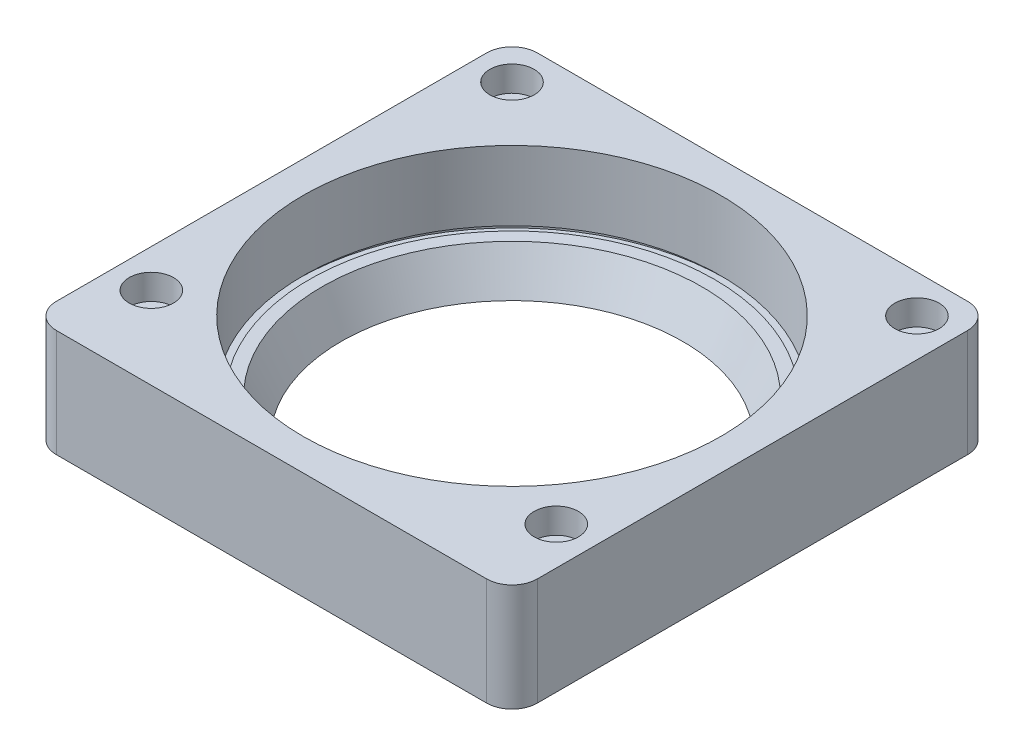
SolidWorks part; units mm, degrees
ref_plane "Plane1" through (0, 0, 0) normal (0, 0, 1) x (1, 0, 0)
ref_plane "Plane2" through (0, 0, 0) normal (0, 1, 0) x (1, 0, 0)
ref_plane "Plane3" through (0, 0, 0) normal (1, 0, 0) x (0, 0, -1)
sketch "Esquisse1" plane through (0, 0, 0) normal (0, 0, 1) x (1, 0, 0)
  line L0 (36, 0) -> (34, 0)
  line L1 (36, 0) -> (36, 6)
  line L2 (36, 6) -> (34, 6)
  line L3 (34, 6) -> (34, 5)
  line L4 (34, 5) -> (32, 5)
  line L5 (32, 5) -> (32, 6)
  line L6 (32, 6) -> (30, 6)
  line L7 (30, 6) -> (27, 0)
  line L8 (32, 0) -> (32, 1.5)
  line L9 (32, 1.5) -> (34, 1.5)
  line L10 (34, 1.5) -> (34, 0)
  line L11 (32, 0) -> (27, 0)
  line L12 (0, 16) -> (0, -10) construction
  dimension "D1" = 2
  dimension "D2" = 1.5
  dimension "D3" = 36
  dimension "D4" = 9
revolve "Base-Révolution" add sketch "Esquisse1" angle 360 about L12
sketch "Esquisse2" plane through (0, 0, 0) normal (0, -1, 0) x (1, 0, 0)
  line L0 (-38, -38) -> (38, -38)
  line L1 (-38, -38) -> (-38, 38)
  line L2 (38, 38) -> (-38, 38)
  line L3 (38, 38) -> (38, -38)
  line L4 (-34.5, -34.5) -> (-34.5, 34.5)
  line L5 (-34.5, 34.5) -> (34.5, 34.5)
  line L6 (34.5, 34.5) -> (34.5, -34.5)
  line L7 (34.5, -34.5) -> (-34.5, -34.5)
  dimension "D1" = 38
  dimension "D2" = 38
  dimension "D3" = 38
  dimension "D4" = 38
  dimension "D5" = 3.5
  dimension "D6" = 3.5
  dimension "D7" = 3.5
  dimension "D8" = 3.5
extrude "Boss.-Extru.1" add sketch "Esquisse2" against normal blind 14
sketch "Esquisse4" plane through (0, 6, 0) normal (0, 1, 0) x (-1, 0, 0)
  circle A0 centre (0, 0) radius 33
  circle A1 centre (0, 0) radius 35
extrude "Boss.-Extru.2" add sketch "Esquisse4" along normal blind 8
sketch "Esquisse5" plane through (0, 14, 0) normal (0, 1, 0) x (-1, 0, 0)
  line L0 (-38, 38) -> (38, 38)
  line L1 (-38, 38) -> (-38, -38)
  line L2 (38, -38) -> (-38, -38)
  line L3 (38, -38) -> (38, 38)
  circle A0 centre (0, 0) radius 33
extrude "Boss.-Extru.3" add sketch "Esquisse5" along normal blind 3
sketch "Esquisse6" plane through (0, 0, 0) normal (0, -1, 0) x (1, 0, 0)
  line L0 (0, 0) -> (0, 52) construction
  line L2 (0, 0) -> (-64, 0) construction
  line L3 (-32, -25) -> (-32, -45) construction
  line L4 (32, -25) -> (32, -45) construction
  line L6 (-59, -32) -> (69, -32) construction
  line L8 (-38, -38) -> (38, -38) construction
  line L9 (38, 38) -> (-38, 38) construction
  circle A0 centre (32, 25) radius 5.5
  circle A1 centre (-32, 25) radius 5.5
  circle A2 centre (-32, -32) radius 5
  circle A3 centre (32, -32) radius 5
  dimension "D3" = 11
  dimension "D1" = 6
  dimension "D2" = 13
extrude "Boss.-Extru.5" add sketch "Esquisse6" against normal blind 17
sketch "Esquisse10" plane through (0, 0, 0) normal (0, -1, 0) x (1, 0, 0)
  circle A0 centre (32, 25) radius 1.5
  circle A1 centre (32, -32) radius 1.5
  circle A2 centre (-32, -32) radius 1.5
  circle A3 centre (-32, 25) radius 1.5
  dimension "D1" = 3
  dimension "D2" = 3
  dimension "D3" = 3
  dimension "D4" = 3
extrude "Enlèv. mat.-Extru.1" cut sketch "Esquisse10" against normal blind 17
sketch "Esquisse11" plane through (0, 17, 0) normal (0, 1, 0) x (-1, 0, 0)
  circle A0 centre (-32, -32) radius 3.5
  circle A1 centre (-32, 25) radius 3.5
  circle A2 centre (32, 25) radius 3.5
  circle A3 centre (32, -32) radius 3.5
  dimension "D1" = 7
  dimension "D2" = 7
  dimension "D3" = 7
  dimension "D4" = 7
extrude "Enlèv. mat.-Extru.2" cut sketch "Esquisse11" against normal blind 4
fillet "Congé1" radius 4
fillet "Congé2" radius 4
fillet "Congé3" radius 1
fillet "Congé4" radius 1
fillet "Congé5" radius 1
fillet "Congé6" radius 1
fillet "Congé7" radius 1
fillet "Congé9" radius 1
fillet "Congé10" radius 1
fillet "Congé11" radius 1
